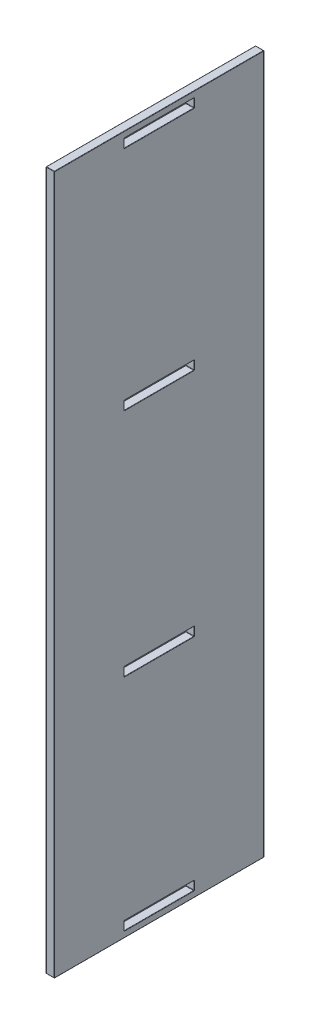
SolidWorks part; units mm, degrees
ref_plane "Front Plane" through (0, 0, 0) normal (0, 0, 1) x (1, 0, 0)
ref_plane "Top Plane" through (0, 0, 0) normal (0, 1, 0) x (1, 0, 0)
ref_plane "Right Plane" through (0, 0, 0) normal (1, 0, 0) x (0, 0, -1)
sketch "Sketch1" plane through (0, 0, 0) normal (1, 0, 0) x (0, 0, -1)
  line L0 (-294.6765, 0) -> (368.7566, 0) construction
  line L1 (-150, 500) -> (150, 500)
  line L2 (-150, 500) -> (-150, -500)
  line L3 (-150, -500) -> (150, -500)
  line L4 (150, 500) -> (150, -500)
  line L5 (-150, 500) -> (150, -500) construction
  line L6 (-150, -500) -> (150, 500) construction
  line L7 (0, 747.3286) -> (0, -620.7227) construction
  line L8 (-184.3816, 485) -> (174.9785, 485) construction
  line L9 (-50, -478.75) -> (50, -491.25) construction
  line L10 (-50, 491.25) -> (50, 491.25)
  line L11 (-50, 491.25) -> (-50, 478.75)
  line L12 (-50, 478.75) -> (50, 478.75)
  line L13 (50, 491.25) -> (50, 478.75)
  line L14 (-50, 491.25) -> (50, 478.75) construction
  line L15 (-50, 478.75) -> (50, 491.25) construction
  line L16 (-50, -491.25) -> (50, -478.75) construction
  line L17 (-184.3816, -485) -> (174.9785, -485) construction
  line L18 (0, -747.3286) -> (0, 620.7227) construction
  line L19 (50, -491.25) -> (50, -478.75)
  line L20 (-50, -478.75) -> (50, -478.75)
  line L21 (-50, -491.25) -> (-50, -478.75)
  line L22 (-50, -491.25) -> (50, -491.25)
  line L23 (-184.3816, 160) -> (254.062, 160) construction
  line L24 (-224.1001, -170) -> (254.062, -170) construction
  line L25 (-50, 166.25) -> (50, 166.25)
  line L26 (-50, 166.25) -> (-50, 153.75)
  line L27 (-50, 153.75) -> (50, 153.75)
  line L28 (50, 166.25) -> (50, 153.75)
  line L29 (-50, 166.25) -> (50, 153.75) construction
  line L30 (-50, 153.75) -> (50, 166.25) construction
  line L32 (-50, -163.75) -> (50, -163.75)
  line L33 (-50, -163.75) -> (-50, -176.25)
  line L34 (-50, -176.25) -> (50, -176.25)
  line L35 (50, -163.75) -> (50, -176.25)
  line L36 (-50, -163.75) -> (50, -176.25) construction
  line L37 (-50, -176.25) -> (50, -163.75) construction
  point P0 (0, 0)
  point P10 (0, 485)
  point P25 (0, -485)
  point P28 (0, 160)
  point P35 (0, -170)
  dimension "D1" = 300
  dimension "D2" = 1000
  dimension "D3" = 15
  dimension "D4" = 100
  dimension "D5" = 12.5
  dimension "D6" = 340
  dimension "D7" = 100
  dimension "D8" = 12.5
  dimension "D9" = 330
  dimension "D10" = 12.5
  dimension "D11" = 100
extrude "Boss-Extrude1" add sketch "Sketch1" along normal blind 12
fillet "Fillet1" radius 0.5 60 edges at (0, -170, -50) (0, -163.75, 0) (0, -170, 50) (0, -176.25, 0) (12, -170, -50) (12, -163.75, 0) (12, -170, 50) (12, -176.25, 0) (6, -176.25, -50) (6, -176.25, 50) (6, -163.75, 50) (6, -163.75, -50) (0, 160, -50) (0, 166.25, 0) (0, 160, 50) (0, 153.75, 0) (12, 160, -50) (12, 166.25, 0) (12, 160, 50) (12, 153.75, 0) (6, 153.75, -50) (6, 153.75, 50) (6, 166.25, 50) (6, 166.25, -50) (0, -485, 50) (0, -491.25, 0) (0, -485, -50) (0, -478.75, 0) (12, -485, 50) (12, -491.25, 0) (12, -485, -50) (12, -478.75, 0) (6, -478.75, 50) (6, -478.75, -50) (6, -491.25, -50) (6, -491.25, 50) (0, 485, -50) (0, 491.25, 0) (0, 485, 50) (0, 478.75, 0) (12, 485, -50) (12, 491.25, 0) (12, 485, 50) (12, 478.75, 0) (6, 478.75, -50) (6, 478.75, 50) (6, 491.25, 50) (6, 491.25, -50) (0, 0, -150) (0, 500, 0) (0, 0, 150) (0, -500, 0) (12, 0, -150) (12, 500, 0) (12, 0, 150) (12, -500, 0) (6, -500, -150) (6, -500, 150) (6, 500, 150) (6, 500, -150)
